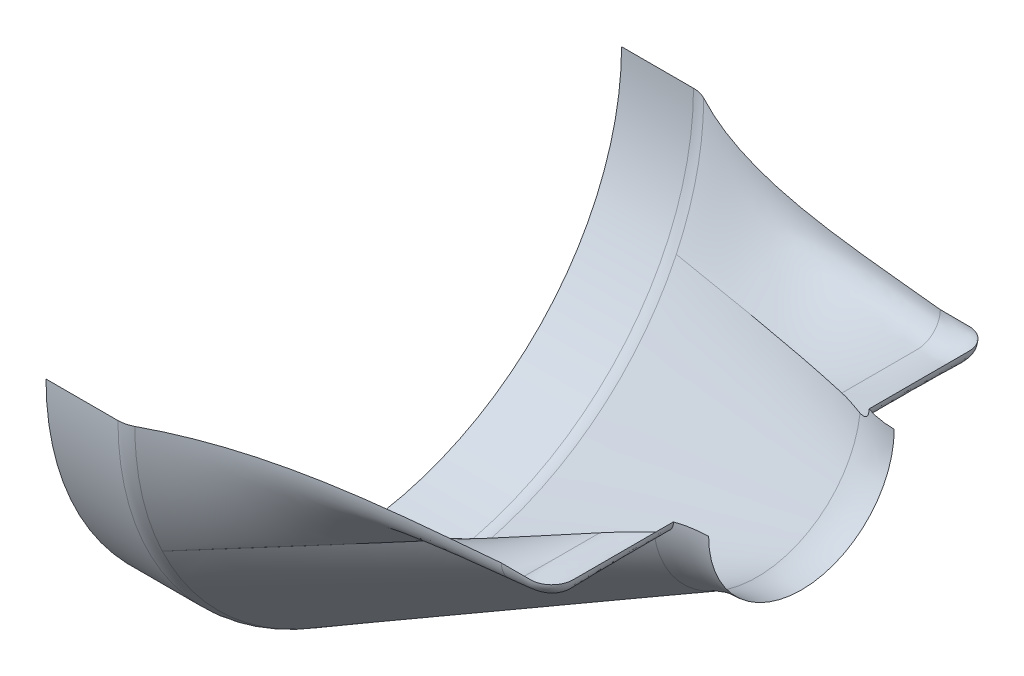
SolidWorks part; units mm, degrees
ref_plane "Vorne" through (0, 0, 0) normal (0, 0, 1) x (1, 0, 0)
ref_plane "Oben" through (0, 0, 0) normal (0, 1, 0) x (1, 0, 0)
ref_plane "Rechts" through (0, 0, 0) normal (1, 0, 0) x (0, 0, -1)
sketch "Skizze1" plane through (0, 0, 0) normal (0, 1, 0) x (1, 0, 0)
  line L0 (0, 0) -> (770.7263, 0) construction
  line L1 (0, 200) -> (50, 200)
  line L2 (59.4254, 197.6398) -> (294.1318, 72.2297)
  line L3 (2, 198) -> (50, 198) construction
  line L4 (0, 198) -> (50, 198) construction
  line L6 (58.4829, 195.8758) -> (293.1892, 70.4658) construction
  line L8 (0, 200) -> (0, 198) construction
  line L9 (448, 0) -> (450, 0) construction
  line L12 (0, 200) -> (0, 196.253) construction
  line L19 (2, 198) -> (2, 196.253) construction
  line L20 (385.5, 64.5) -> (325, 64.5) construction
  line L21 (385.5, 62.5) -> (325, 62.5) construction
  arc A0 (50, 200) -> (59.4254, 197.6398) centre (50, 180) cw
  arc A1 (50, 198) -> (58.4829, 195.8758) centre (50, 180) cw construction
  arc A2 (325, 62.5) -> (293.1892, 70.4658) centre (325, 130) cw construction
  arc A4 (325, 64.5) -> (294.1318, 72.2297) centre (325, 130) cw
  arc A9 (385.5, 64.5) -> (450, 0) centre (385.5, 0) cw construction
  arc A10 (385.5, 62.5) -> (448, 0) centre (385.5, 0) cw construction
  point P14 (87.3818, 188.4588)
  point P15 (510.3654, -55.7509)
  dimension "D2" = 20
  dimension "D4" = 2
  dimension "D5" = 65.5
  dimension "D3" = 400
  dimension "D6" = 50
  dimension "D8" = 325
  dimension "D13" = 450
surface "Oberfläche-Rotation1" sketch "Skizze1" parameters "D1"=180
ref_plane "Ebene1" through (100, 0, 0) normal (1, 0, 0) x (0, 0, -1)
ref_plane "Ebene2" through (269, 0, 0) normal (1, 0, 0) x (0, 0, -1)
sketch "Skizze12" plane through (0, 0, 0) normal (0, 0, 1) x (1, 0, 0)
  line L0 (269, 43.8329) -> (269, -185.9672)
  line L3 (0, -200) -> (0, 0) construction
  dimension "D1" = 269
sketch "Skizze9" plane through (0, 0, 0) normal (0, 0, 1) x (1, 0, 0)
  line L0 (-18.0175, -109.937) -> (269, -16)
  line L1 (269, -16) -> (269, 0) construction
  line L2 (269, 0) -> (269, -85.6583) construction
sketch "Skizze11" plane through (269, 0, 0) normal (1, 0, 0) x (0, 0, -1)
  line L0 (-136.5, -16) -> (-81.0952, -16) construction
  line L2 (-136.5, -16) -> (-84.1508, -16)
  arc A0 (-152.5, 0) -> (-136.5, -16) centre (-136.5, 0) ccw construction
  arc A2 (-152.5, 0) -> (-136.5, -16) centre (-136.5, 0) ccw
other "Fläche löschen1"
surface "Oberfläche-Ausformung1"
sketch "Skizze14" plane through (0, 0, 0) normal (0, 1, 0) x (1, 0, 0)
  line L0 (269, -152.5) -> (289, -152.5)
  line L1 (304, -137.5) -> (304, -62.4351)
  line L2 (269, -152.5) -> (269, -84.1508) construction
  arc A0 (289, -152.5) -> (304, -137.5) centre (289, -137.5) ccw
  dimension "D2" = 15
  dimension "D1" = 35
ref_plane "Ebene3" through (0, 0, 130) normal (0, 0, 1) x (1, 0, 0)
sketch "Skizze15" plane through (0, 0, 130) normal (0, 0, 1) x (1, 0, 0)
  line L0 (269, -16) -> (289, -16)
  line L1 (304, -1) -> (304, 0)
  line L3 (294.1318, 0) -> (325, 0) construction
  arc A0 (289, -16) -> (304, -1) centre (289, -1) ccw
  dimension "D1" = 15
surface "Oberfläche-Ausformung5"
mirror "Spiegeln1" about plane through (0, 0, 0) normal (0, 0, 1)
surface "Oberfläche-Trimmen1"
surface "Oberfläche-Trimmen2"
surface "Oberfläche-Zusammenfügen2"
